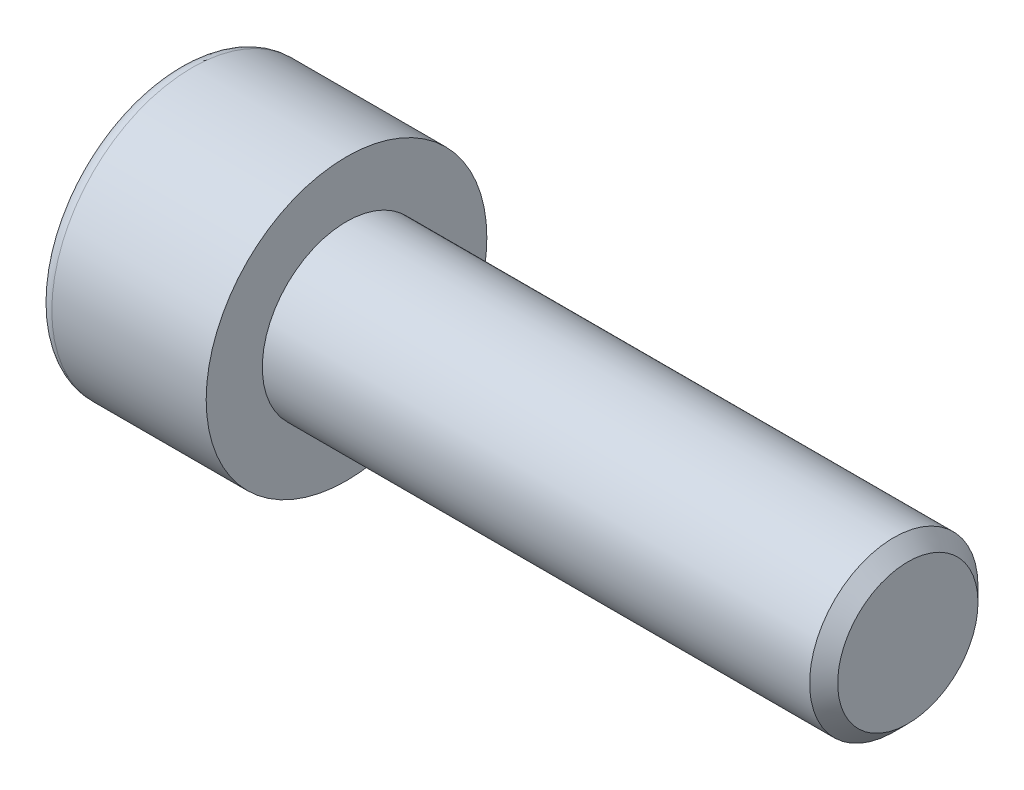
SolidWorks part; units mm, degrees
ref_plane "Plan1" through (0, 0, 0) normal (0, 0, 1) x (1, 0, 0)
ref_plane "Plan2" through (0, 0, 0) normal (0, 1, 0) x (1, 0, 0)
ref_plane "Plan3" through (0, 0, 0) normal (1, 0, 0) x (0, 0, -1)
sketch "Esquisse1" plane through (0, 0, 0) normal (0, 0, 1) x (1, 0, 0)
  line L0 (12.5013, 0) -> (-4.9882, 0) construction
  line L1 (0, 3) -> (0, 5)
  line L2 (0, 3) -> (20, 3)
  line L3 (20, 3) -> (20, 0)
  line L4 (0, 5) -> (-6, 5)
  line L5 (-6, 5) -> (-6, 0)
  line L6 (20, 0) -> (-6, 0)
  dimension "Ø tige" = 6
  dimension "Ø tete" = 10
  dimension "longueur tige" = 20
  dimension "hauteur tete" = 6
revolve "Base-Révolution" add sketch "Esquisse1" angle 360 about L0
chamfer "Chanfrein tige" distance 0.5 angle 45 1 edges at (20, 0, -3)
fillet "Congé tete" radius 0.5 1 edges at (-6, 0, -5)
sketch "Esquisse2" plane through (-6, 0, 0) normal (-1, 0, 0) x (0, 0, 1)
  line L1 (2.8868, 0) -> (1.4434, 2.5)
  line L2 (1.4434, 2.5) -> (-1.4434, 2.5)
  line L3 (-1.4434, 2.5) -> (-2.8868, 0)
  line L4 (-2.8868, 0) -> (-1.4434, -2.5)
  line L5 (-1.4434, -2.5) -> (1.4434, -2.5)
  line L6 (1.4434, -2.5) -> (2.8868, 0)
  circle A0 centre (0, 0) radius 2.5 construction
  dimension "largeur creux" = 5
extrude "Enlèv. mat.-Extru.1" cut sketch "Esquisse2" against normal blind 3.78
sketch "Esquisse3" plane through (-2.22, 0, 0) normal (-1, 0, 0) x (0, 0, 1)
  circle A0 centre (0, 0) radius 0.5
  dimension "D1" = 1
extrude "Enlèv. mat.-Extru.2" [suppressed] cut sketch "Esquisse3" against normal through all
